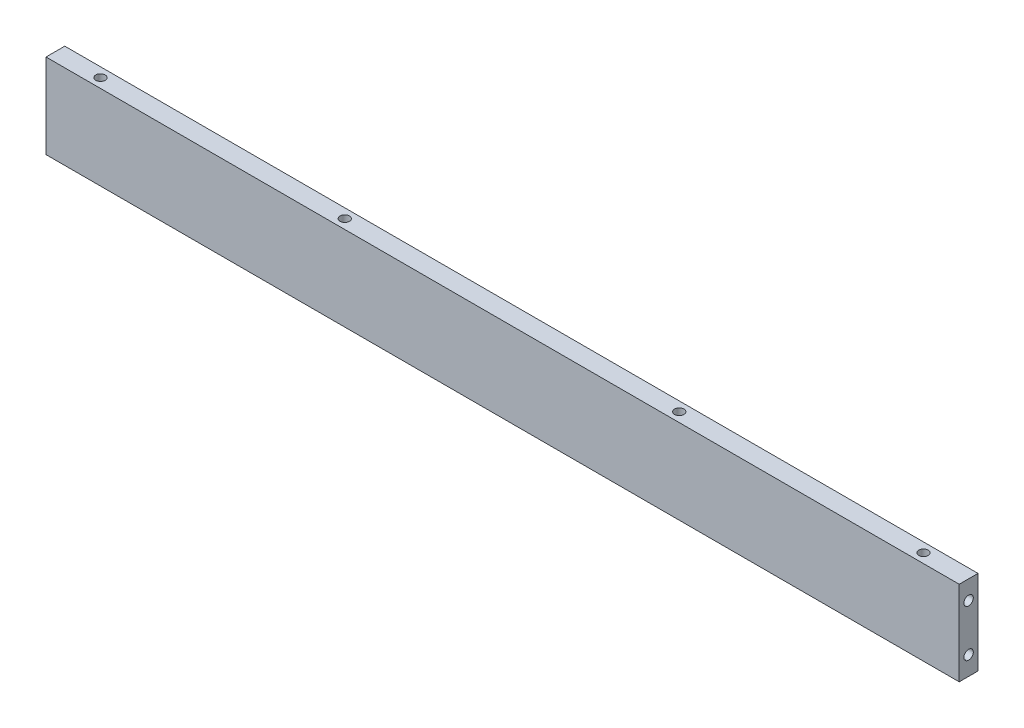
SolidWorks part; units mm, degrees
ref_plane "Front Plane" through (0, 0, 0) normal (0, 0, 1) x (1, 0, 0)
ref_plane "Top Plane" through (0, 0, 0) normal (0, 1, 0) x (1, 0, 0)
ref_plane "Right Plane" through (0, 0, 0) normal (1, 0, 0) x (0, 0, -1)
sketch "Sketch1" plane through (0, 0, 0) normal (0, 0, 1) x (1, 0, 0)
  line L1 (-308.61, 28.575) -> (308.61, 28.575)
  line L2 (-308.61, 28.575) -> (-308.61, -28.575)
  line L3 (-308.61, -28.575) -> (308.61, -28.575)
  line L4 (308.61, 28.575) -> (308.61, -28.575)
  line L5 (-308.61, 28.575) -> (308.61, -28.575) construction
  line L6 (-308.61, -28.575) -> (308.61, 28.575) construction
  point P0 (0, 0)
  dimension "D1" = 617.22
  dimension "D2" = 57.15
extrude "Boss-Extrude1" add sketch "Sketch1" along normal mid plane 12.7
sketch "Sketch2" plane through (0, 28.575, 0) normal (0, 1, 0) x (1, 0, 0)
  line L0 (0, -1000) -> (0, 49000) construction
  line L1 (-1000, 0) -> (49000, 0) construction
  line L2 (308.61, -6.35) -> (308.61, 6.35) construction
  circle A0 centre (278.13, 0) radius 3.175
  circle A1 centre (113.03, 0) radius 3.175
  dimension "D1" = 30.48
  dimension "D3" = 6.35
  dimension "D2" = 165.1
extrude "Cut-Extrude1" cut sketch "Sketch2" against normal blind 19.05
mirror "Mirror1" about plane through (0, 0, 0) normal (1, 0, 0) of "Cut-Extrude1"
sketch "Sketch3" plane through (308.61, 0, 0) normal (1, 0, 0) x (0, 0, -1)
  line L0 (0, -1000) -> (0, 49000) construction
  line L1 (-1000, 0) -> (49000, 0) construction
  line L2 (-6.35, -28.575) -> (6.35, -28.575) construction
  circle A0 centre (0, -15.875) radius 3.175
  circle A1 centre (0, 15.875) radius 3.175
  dimension "D1" = 6.35
  dimension "D2" = 12.7
  dimension "D3" = 31.75
extrude "Cut-Extrude2" cut sketch "Sketch3" against normal blind 19.05
mirror "Mirror2" about plane through (0, 0, 0) normal (1, 0, 0) of "Cut-Extrude2"
